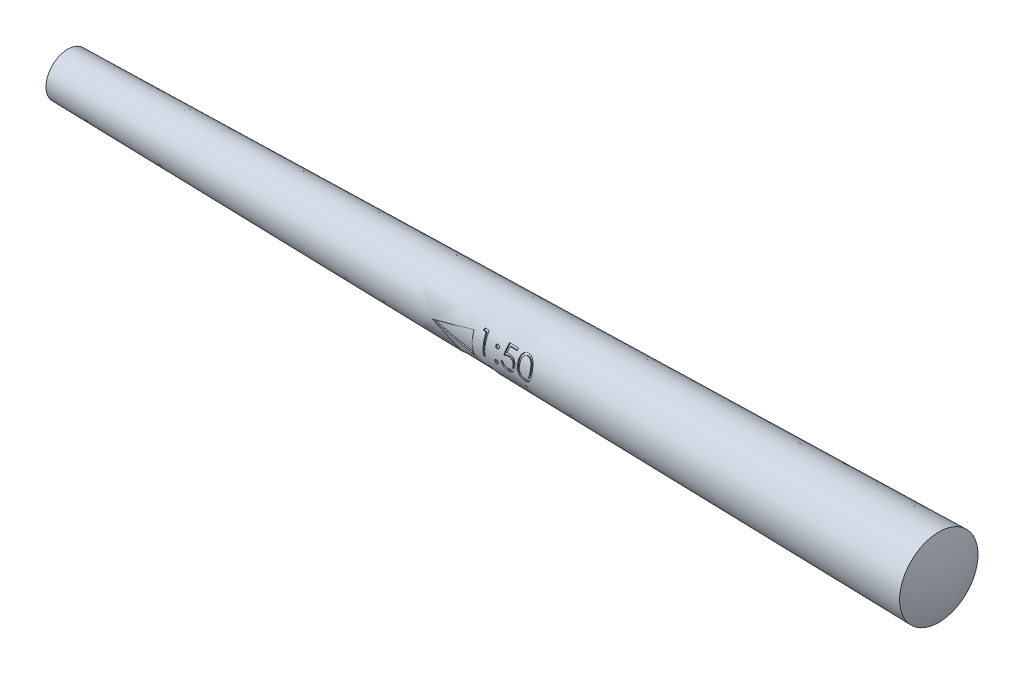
SolidWorks part; units mm, degrees
ref_plane "Front Plane" through (0, 0, 0) normal (0, 0, 1) x (1, 0, 0)
ref_plane "Top Plane" through (0, 0, 0) normal (0, 1, 0) x (1, 0, 0)
ref_plane "Right Plane" through (0, 0, 0) normal (1, 0, 0) x (0, 0, -1)
sketch "Sketch1" plane through (0, 0, 0) normal (1, 0, 0) x (0, 0, -1)
  circle A0 centre (0, 0) radius 1
  dimension "D1" = 2
extrude "Extrude1" add sketch "Sketch1" along normal mid plane 40
draft "Draft1" type of draft neutral plane draft angle 1.146 faces to draft 1 parameters "D1"=1.146
sketch "Sketch2" plane through (0, 0, 0) normal (0, 0, 1) x (1, 0, 0)
  line L0 (-20, 0) -> (-20, 1)
  line L1 (-20, 1) -> (-20, -1) construction
  line L2 (-20, 0) -> (-20.3, 0)
  line L3 (-20.3, 0) -> (-20.3, -1.4) construction
  line L4 (20, 0) -> (20, 1.8)
  line L5 (20, -1.8) -> (20, 1.8) construction
  line L6 (20, 0) -> (20.3, 0)
  line L7 (20.3, 0) -> (20.3, -1.4) construction
  line L8 (-20, -1) -> (20, -1.8) construction
  arc A0 (-20.3, 0) -> (-20, 1) centre (-18.4833, 0) cw
  arc A1 (20.3, 0) -> (20, 1.8) centre (14.7498, 0) ccw
  point P14 (0, -1.4)
revolve "Revolve1" add sketch "Sketch2" angle 360 about L2
sketch "Sketch5" plane through (0, 0, 0) normal (0, 0, 1) x (1, 0, 0)
  line L0 (0, 1.4) -> (0, -1.4) construction
  line L1 (20, 1.8) -> (-20, 1) construction
  line L2 (-20, -1) -> (20, -1.8) construction
ref_plane "Plane2" through (0, 0, 0) normal (-0.02, 0, 0.9998) x (0.9998, 0, 0.02)
sketch "Sketch6" plane through (0, 0, 0) normal (-0.02, 0, 0.9998) x (0.9998, 0, 0.02)
  line L0 (0, 0) -> (0, 0.5)
  line L1 (0, 1.4) -> (0, -1.4) construction
  line L2 (0, 0.5) -> (-1.866, 0)
  line L3 (-1.866, 0) -> (0, -0.5)
  line L4 (0, -0.5) -> (0, 0)
  line L5 (0, -0.25) -> (3, -0.25) construction
  text T0 "1:50" font "Century Gothic" height 1
  dimension "D1" = 1
  dimension "D2" = 30
  dimension "D3" = 3
wrap "Wrap2" sketch "Sketch6" wrap type deboss source sketch "Sketch6" thickness 0.05 parameters "D1"=0.05
equation "\"D2@Sketch2\" = \"D1@Sketch2\""
